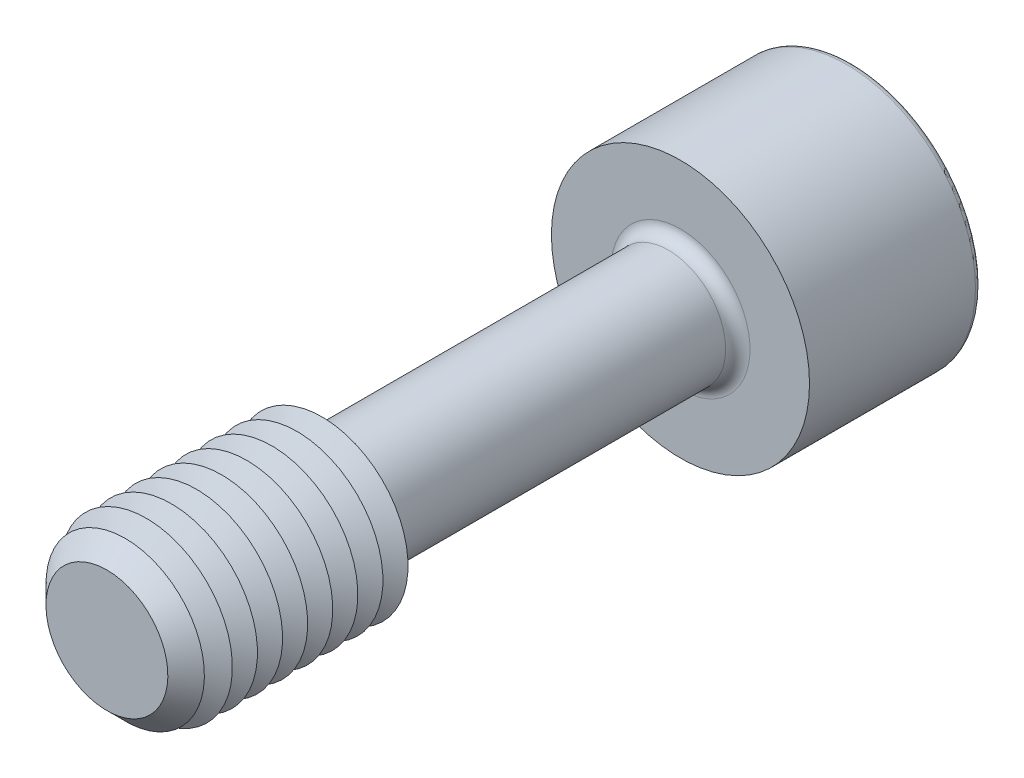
SolidWorks part; units mm, degrees
ref_plane "Front Plane" through (0, 0, 0) normal (0, 0, 1) x (1, 0, 0)
ref_plane "Top Plane" through (0, 0, 0) normal (0, 1, 0) x (1, 0, 0)
ref_plane "Right Plane" through (0, 0, 0) normal (1, 0, 0) x (0, 0, -1)
sketch "Sketch1" plane through (0, 0, 0) normal (0, 0, 1) x (1, 0, 0)
  circle A0 centre (0, 0) radius 4
  dimension "D1" = 8
extrude "Extrude1" add sketch "Sketch1" along normal mid plane 40
sketch "Sketch2" plane through (0, 0, 0) normal (1, 0, 0) x (0, 0, -1)
  line L0 (-20, 0) -> (-20, 6)
  line L1 (-20, 4) -> (-20, -4) construction
  line L2 (-20, 6) -> (-5, 6)
  line L3 (-5, 6) -> (-3.8453, 4)
  line L4 (20, 4) -> (-20, 4) construction
  line L5 (-3.8453, 4) -> (-3.8453, 0)
  line L6 (-3.8453, 0) -> (-20, 0)
  dimension "D1" = 6
  dimension "D2" = 120
  dimension "D3" = 15
revolve "Revolve1" add sketch "Sketch2" angle 360 about L6
chamfer "Chamfer1" distance 1.75 angle 45 1 edges at (0, 6, 20)
sketch "Sketch3" plane through (0, 0, -20) normal (0, 0, -1) x (-1, 0, 0)
  circle A0 centre (0, 0) radius 9
  dimension "D1" = 18
extrude "Extrude2" add sketch "Sketch3" along normal blind 12
sketch "Sketch4" plane through (-13.7, 0, -32) normal (0, 0, 1) x (1, 0, 0)
  line L2 (10.8132, -5) -> (16.5868, -5)
  line L3 (16.5868, -5) -> (19.4735, 0)
  line L4 (19.4735, 0) -> (16.5868, 5)
  line L6 (16.5868, 5) -> (10.8132, 5)
  line L7 (10.8132, 5) -> (7.9265, 0)
  line L8 (7.9265, 0) -> (10.8132, -5)
  circle A0 centre (13.7, 0) radius 5 construction
  dimension "D1" = 10
extrude "Extrude3" cut sketch "Sketch4" along normal blind 10
fillet "Fillet1" radius 0.85 1 edges at (-4, 0, -20)
fillet "Fillet2" radius 0.425 1 edges at (-9, 0, -32)
sketch "Sketch5" plane through (0, 0, 0) normal (1, 0, 0) x (0, 0, -1)
  line L0 (22, 0) -> (22, -5)
  line L1 (22, -5) -> (19.1132, 0)
  line L2 (19.1132, 0) -> (22, 0)
  dimension "D1" = 30
revolve "Cut-Revolve1" cut sketch "Sketch5" angle 360 about L2
sketch "Sketch6" plane through (0, 0, 0) normal (1, 0, 0) x (0, 0, -1)
  line L0 (1.332, 0) -> (-13.289, 0) construction
sketch "Sketch7" plane through (0, 0, 0) normal (1, 0, 0) x (0, 0, -1)
  line L0 (-5, 6) -> (-5.875, 4.4845)
  line L1 (-5.875, 4.4845) -> (-6.75, 6)
  line L2 (-5, 6) -> (-18.25, 6) construction
  line L3 (-6.75, 6) -> (-5, 6)
  dimension "D1" = 1.75
revolve "Cut-Revolve2" cut sketch "Sketch7" angle 360 about L0
pattern_linear "LPattern1" count 8 spacing 1.75 along (0, 0, 1) of "Cut-Revolve2"
